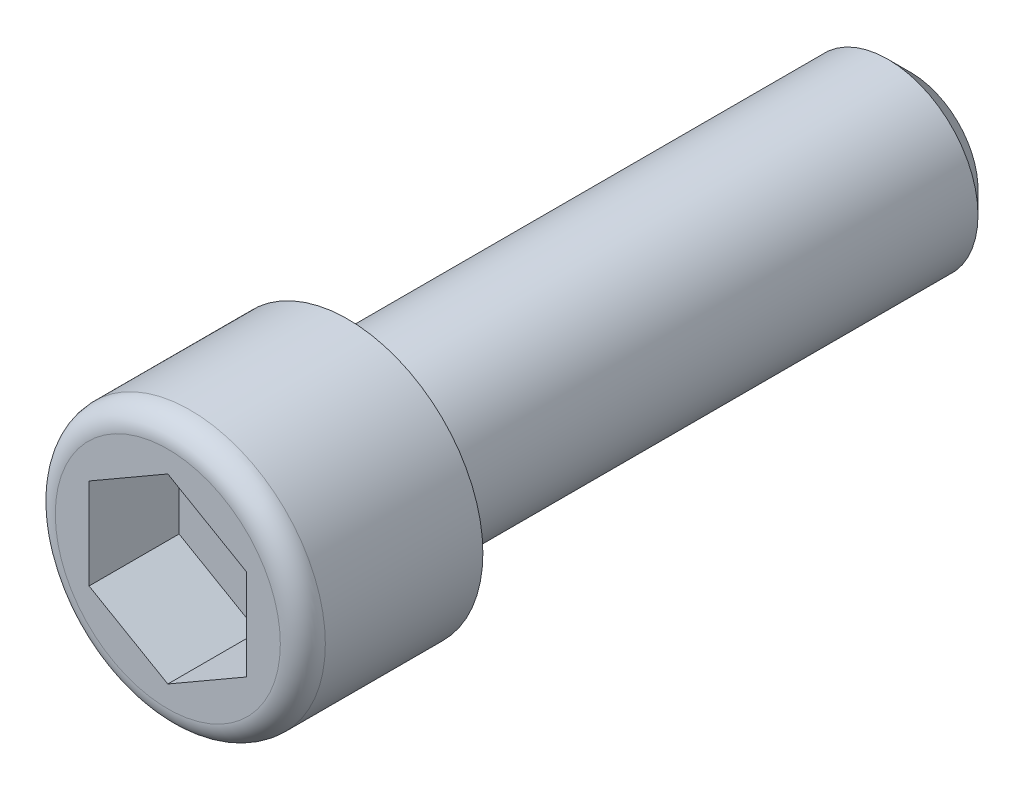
SolidWorks part; units mm, degrees
ref_plane "Face" through (0, 0, 0) normal (0, 0, 1) x (1, 0, 0)
ref_plane "Dessus" through (0, 0, 0) normal (0, 1, 0) x (1, 0, 0)
ref_plane "Droite" through (0, 0, 0) normal (1, 0, 0) x (0, 0, -1)
sketch "Esquisse1" plane through (0, 0, 0) normal (0, 0, 1) x (1, 0, 0)
  circle A0 centre (0, 0) radius 6
  dimension "D1" = 12
extrude "Base-Extrusion" add sketch "Esquisse1" against normal blind 8
sketch "Esquisse2" plane through (0, 0, -8) normal (0, 0, -1) x (-1, 0, 0)
  circle A0 centre (0, 0) radius 4
  dimension "D1" = 8
extrude "Boss.-Extru.1" add sketch "Esquisse2" along normal blind 25
chamfer "Chanfrein1" distance 1 angle 45 1 edges at (-4, 0, -33)
sketch "Esquisse3" plane through (0, 0, 0) normal (0, 0, 1) x (1, 0, 0)
  line L1 (-3.5, -2.0207) -> (0, -4.0415)
  line L2 (0, -4.0415) -> (3.5, -2.0207)
  line L3 (3.5, -2.0207) -> (3.5, 2.0207)
  line L4 (3.5, 2.0207) -> (0, 4.0415)
  line L5 (0, 4.0415) -> (-3.5, 2.0207)
  line L6 (-3.5, 2.0207) -> (-3.5, -2.0207)
  circle A0 centre (0, 0) radius 3.5 construction
  dimension "D1" = 7
extrude "Enlèv. mat.-Extru.1" cut sketch "Esquisse3" against normal blind 4
fillet "Congé1" radius 1 1 edges at (6, 0, 0)
